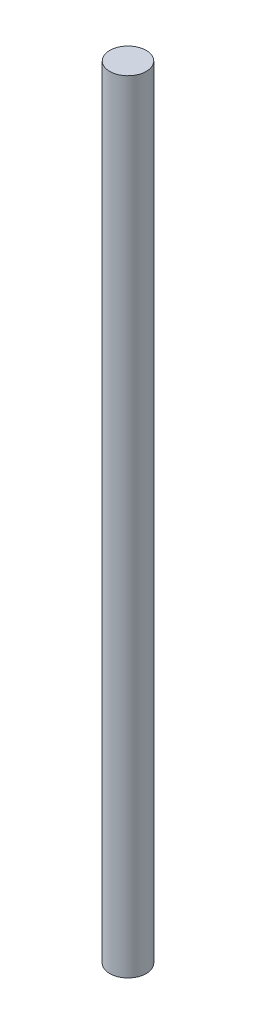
SolidWorks part; units mm, degrees
ref_plane "前视基准面" through (0, 0, 0) normal (0, 0, 1) x (1, 0, 0)
ref_plane "上视基准面" through (0, 0, 0) normal (0, 1, 0) x (1, 0, 0)
ref_plane "右视基准面" through (0, 0, 0) normal (1, 0, 0) x (0, 0, -1)
sketch "草图1" plane through (0, 0, 0) normal (0, 1, 0) x (1, 0, 0)
  circle A0 centre (-0.8823, 0.7352) radius 1.75
  dimension "D1" = 3.5
extrude "凸台-拉伸1" add sketch "草图1" along normal blind 75
